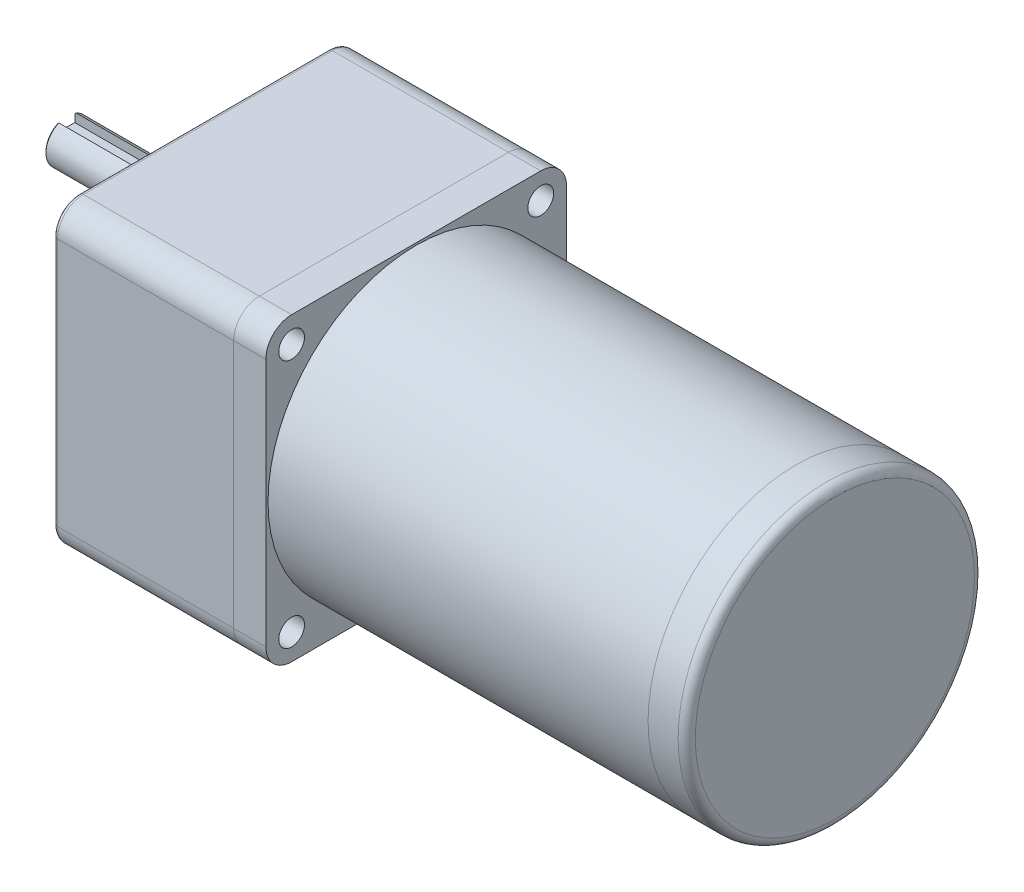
SolidWorks part; units mm, degrees
ref_plane "前视基准面" through (0, 0, 0) normal (0, 0, 1) x (1, 0, 0)
ref_plane "上视基准面" through (0, 0, 0) normal (0, 1, 0) x (1, 0, 0)
ref_plane "右视基准面" through (0, 0, 0) normal (1, 0, 0) x (0, 0, -1)
sketch "草图1" plane through (0, 0, 0) normal (1, 0, 0) x (0, 0, -1)
  line L1 (29, -35) -> (-29, -35)
  line L2 (35, -29) -> (35, 29)
  line L3 (29, 35) -> (-29, 35)
  line L4 (-35, -29) -> (-35, 29)
  line L5 (35, -35) -> (-35, 35) construction
  line L6 (35, 35) -> (-35, -35) construction
  arc A0 (-29, -35) -> (-35, -29) centre (-29, -29) cw
  arc A1 (29, -35) -> (35, -29) centre (29, -29) ccw
  arc A2 (35, 29) -> (29, 35) centre (29, 29) ccw
  arc A3 (-29, 35) -> (-35, 29) centre (-29, 29) ccw
  point P0 (0, 0)
  dimension "D1" = 6
extrude "凸台-拉伸1" add sketch "草图1" along normal blind 42
sketch "草图2" plane through (42, 0, 0) normal (1, 0, 0) x (0, 0, -1)
  line L0 (29, 35) -> (-29, 35) construction
  line L1 (-29, -35) -> (29, -35)
  line L2 (-35, -29) -> (-35, 29)
  line L3 (-29, 35) -> (29, 35)
  line L4 (35, -29) -> (35, 29)
  line L5 (-35, -35) -> (35, 35) construction
  line L6 (-35, 35) -> (35, -35) construction
  arc A0 (29, 35) -> (35, 29) centre (29, 29) cw
  arc A1 (29, -35) -> (35, -29) centre (29, -29) ccw
  arc A2 (-29, -35) -> (-35, -29) centre (-29, -29) cw
  arc A3 (-35, 29) -> (-29, 35) centre (-29, 29) cw
  point P0 (0, 0)
  dimension "D1" = 6
extrude "凸台-拉伸2" add sketch "草图2" along normal blind 7.5 separate body
fillet "圆角1" radius 1 8 edges at (0, -35, 0) (0, -33.2426, -33.2426) (0, 0, -35) (0, 33.2426, -33.2426) (0, 35, 0) (0, 33.2426, 33.2426) (0, 0, 35) (0, -33.2426, 33.2426)
sketch "草图5" plane through (0, 0, 0) normal (-1, 0, 0) x (0, 0, 1)
  point P19 (-28.9914, 28.9914)
  point P20 (28.9914, 28.9914)
  point P21 (28.9914, -28.9914)
  point P22 (-28.9914, -28.9914)
hole_wizard "M5 螺纹孔1" positions "3D草图1" profile "草图6" tap size "M5" standard "GB"
sketch3d "3D草图1"
  point P0 (0, 28.9914, -28.9914)
  point P3 (0, -28.9914, -28.9914)
  point P6 (0, -28.9914, 28.9914)
  point P9 (0, 28.9914, 28.9914)
sketch "草图6" plane through (0, 28.9914, -28.9914) normal (0, 1, 0) x (0, 0, 1)
  line L0 (0, 0) -> (0, 15.2618)
  line L1 (0, 15.2618) -> (2.1, 14)
  line L2 (2.1, 14) -> (2.1, 0)
  line L5 (2.1, 0) -> (0, 0)
  line L10 (0, 15.2618) -> (-2.1, 14) construction
  line L11 (0, -6.35) -> (0, 107.95) construction
  dimension "螺纹孔钻头直径" = 4.2
  dimension "螺纹孔钻头深度" = 14
  dimension "导头角度" = 118
sketch "草图7" plane through (49.5, 0, 0) normal (1, 0, 0) x (0, 0, -1)
  circle A1 centre (-29, 29) radius 3
  circle A2 centre (29, 29) radius 3
  circle A3 centre (29, -29) radius 3
  circle A4 centre (-29, -29) radius 3
extrude "切除-拉伸1" cut sketch "草图7" against normal blind 35.5
sketch "草图8" plane through (0, 0, 0) normal (-1, 0, 0) x (0, 0, 1)
  circle A0 centre (0, 15) radius 12
extrude "凸台-拉伸5" add sketch "草图8" along normal blind 3 separate body
sketch "草图9" plane through (-3, 0, 0) normal (-1, 0, 0) x (0, 0, 1)
  circle A0 centre (0, 15) radius 5
extrude "凸台-拉伸6" add sketch "草图9" along normal blind 29 separate body
fillet "圆角3" radius 0.5 1 edges at (-3, 15, 12)
sketch "草图10" plane through (0, 0, 0) normal (-1, 0, 0) x (0, 0, 1)
  circle A0 centre (0, 0) radius 30
extrude "切除-拉伸2" cut sketch "草图10" against normal blind 0.5
ref_plane "基准面1" through (0, 20, 0) normal (0, 1, 0) x (1, 0, 0)
sketch "草图11" plane through (0, 20, 0) normal (0, 1, 0) x (1, 0, 0)
  line L1 (-32, 5) -> (-32, -5) construction
  line L2 (-9, 2) -> (-32, 2)
  line L3 (-32, 2) -> (-32, -2)
  line L4 (-32, -2) -> (-9, -2)
  arc A0 (-9, -2) -> (-9, 2) centre (-9, 0) ccw
extrude "切除-拉伸3" cut sketch "草图11" against normal blind 2.5
chamfer "倒角1" distance 0.3 angle 45 1 edges at (-32, 10, 0)
sketch "草图12" plane through (49.5, 0, 0) normal (1, 0, 0) x (0, 0, -1)
  circle A0 centre (0, 0) radius 34.5
extrude "凸台-拉伸7" add sketch "草图12" along normal blind 88.5 separate body
sketch "草图13" plane through (138, 0, 0) normal (1, 0, 0) x (0, 0, -1)
  circle A0 centre (0, 0) radius 34.5
extrude "凸台-拉伸8" add sketch "草图13" along normal blind 9 separate body
fillet "圆角4" radius 2 1 edges at (147, 0, -34.5)
